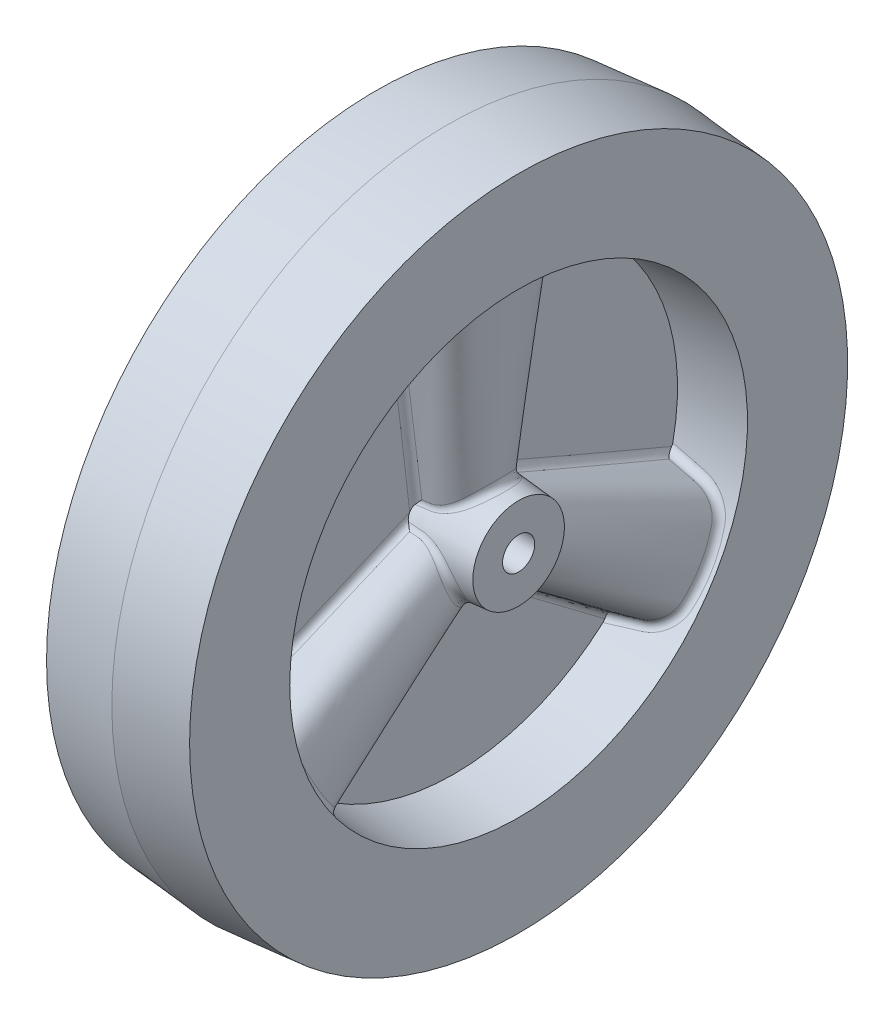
SolidWorks part; units mm, degrees
ref_plane "Front" through (0, 0, 0) normal (0, 0, 1) x (1, 0, 0)
ref_plane "Top" through (0, 0, 0) normal (0, 1, 0) x (1, 0, 0)
ref_plane "Right" through (0, 0, 0) normal (1, 0, 0) x (0, 0, -1)
sketch "Sketch1" plane through (0, 0, 0) normal (0, 0, 1) x (1, 0, 0)
  line L0 (0, 0) -> (0, 74.4139) construction
  line L1 (15.875, 0) -> (-15.875, 0)
  line L2 (1.5875, 11.41) -> (1.5875, 49.55)
  line L3 (1.5875, 49.55) -> (15.875, 50.8)
  line L4 (15.875, 50.8) -> (15.875, 73.025)
  line L5 (15.875, 73.025) -> (0, 74.4139)
  line L6 (0, 0) -> (15.875, 0) construction
  line L7 (-15.875, 73.025) -> (0, 74.4139)
  line L8 (-15.875, 50.8) -> (-15.875, 73.025)
  line L9 (-1.5875, 49.55) -> (-15.875, 50.8)
  line L10 (-1.5875, 11.41) -> (-1.5875, 49.55)
  line L11 (1.5875, 11.41) -> (15.875, 10.16)
  line L12 (-1.5875, 11.41) -> (-15.875, 10.16)
  line L13 (-15.875, 10.16) -> (-15.875, 0)
  line L14 (15.875, 10.16) -> (15.875, 0)
  line L15 (1.5875, 11.41) -> (15.875, 11.41) construction
  line L16 (-15.875, 61.9125) -> (15.875, 61.9125) construction
  dimension "D1" = 3.175
  dimension "D2" = 5
  dimension "D3" = 5
  dimension "D4" = 5
  dimension "D5" = 31.75
  dimension "D6" = 101.6
  dimension "D7" = 146.05
  dimension "D8" = 10.16
revolve "Base-Revolve" add sketch "Sketch1" angle 360 about L6
sketch "Sketch2" plane through (0, 0, 0) normal (0, 1, 0) x (1, 0, 0)
  line L0 (0, 0) -> (52.9894, 0) construction
  line L1 (0, -7.9269) -> (0, 7.9269)
  line L2 (0, 7.9269) -> (3.8391, 7.591)
  line L3 (0, -7.9269) -> (3.8391, -7.591)
  line L4 (0, -74.4139) -> (0, 74.4139) construction
  arc A0 (3.8391, 7.591) -> (3.8391, -7.591) centre (3.175, 0) cw
  point P5 (0, 0)
  dimension "D2" = 7.62
  dimension "D1" = 5
  dimension "D3" = 3.175
ref_plane "Loft Sketch" through (0, 61.9125, 0) normal (0, 1, 0) x (-1, 0, 0)
sketch "Sketch3" plane through (0, 61.9125, 0) normal (0, 1, 0) x (-1, 0, 0)
  line L0 (0, 0) -> (-57.0557, 0) construction
  line L1 (0, 15.875) -> (0, -15.875)
  line L2 (0, 74.4139) -> (0, -74.4139) construction
  line L3 (0, -15.875) -> (-9.581, -13.3078)
  line L4 (0, 15.875) -> (-9.581, 13.3078)
  line L5 (-14.2875, 7.1741) -> (-14.2875, -7.1741)
  line L6 (-15.875, 73.025) -> (-15.875, -73.025) construction
  arc A0 (-14.2875, -7.1741) -> (-9.581, -13.3078) centre (-7.9375, -7.1741) ccw
  arc A1 (-14.2875, 7.1741) -> (-9.581, 13.3078) centre (-7.9375, 7.1741) cw
  point P7 (0, 0)
  dimension "D1" = 6.35
  dimension "D2" = 6.35
  dimension "D3" = 31.75
  dimension "D4" = 15
  dimension "D5" = 1.5875
loft "Boss-Loft1" add profiles "Sketch3", "Sketch2"
pattern_circular "CirPattern2" count 3 over 360 about axis through (0, 0, 0) along (1, 0, 0)
combine bodies "Combine1" operation type add bodies to combine 101 102 106 107
fillet "Fillet1" radius 1.5875 12 edges at (11.3785, -4.961, 9.3147) (1.5875, -8.7177, 40.2874) (1.5875, -26.0312, 21.7493) (13.6392, -24.6033, 44.2208) (11.3785, -5.5862, -8.9537) (1.5875, -24.9524, -20.323) (1.5875, -5.1894, -31.9258) (13.6392, -25.9947, -43.4175) (11.3785, 10.5472, -0.361) (1.5875, 30.3852, 11.4864) (1.5875, 39.5326, -12.6295) (13.6392, 50.598, -0.8033)
sketch "Sketch4" plane through (15.875, 0, 0) normal (1, 0, 0) x (0, 0, -1)
  circle A0 centre (0, 0) radius 3.5719
  dimension "D1" = 7.1437
extrude "Cut-Extrude1" cut sketch "Sketch4" against normal through all
sketch "Sketch5" plane through (15.875, 0, 0) normal (1, 0, 0) x (0, 0, -1)
  line L0 (0, 0) -> (0, -74.4139) construction
  circle A0 centre (0, 0) radius 74.4139 construction
ref_plane "BOTTOM" through (0, -74.4139, 0) normal (0, 1, 0) x (-1, 0, 0)
